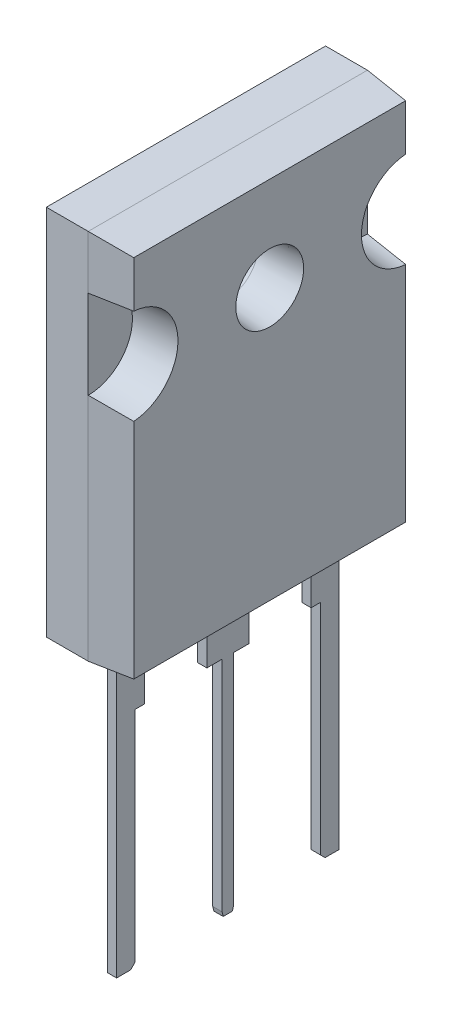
SolidWorks part; units mm, degrees
ref_plane "Front Plane" through (0, 0, 0) normal (0, 0, 1) x (1, 0, 0)
ref_plane "Top Plane" through (0, 0, 0) normal (0, 1, 0) x (1, 0, 0)
ref_plane "Right Plane" through (0, 0, 0) normal (1, 0, 0) x (0, 0, -1)
sketch "Sketch2" plane through (0, 0, 0) normal (1, 0, 0) x (0, 0, -1)
  line L0 (7.62, -2.413) -> (7.62, -14.986)
  line L1 (-7.62, 5.334) -> (7.62, 5.334)
  line L2 (-7.62, 5.334) -> (-7.62, 2.413)
  line L3 (-7.62, -14.986) -> (7.62, -14.986)
  line L4 (7.62, 5.334) -> (7.62, 2.413)
  line L5 (0, -17.9025) -> (0, 11.7071) construction
  line L6 (-7.62, -2.413) -> (-7.62, -14.986)
  arc A1 (7.62, 2.413) -> (7.62, -2.413) centre (7.62, 0) ccw
  arc A2 (-7.62, 2.413) -> (-7.62, -2.413) centre (-7.62, 0) cw
  dimension "D1" = 5.334
  dimension "D6" = 4.826
  dimension "D2" = 7.62
  dimension "D3" = 2.921
  dimension "D5" = 20.32
extrude "Extrude1" add sketch "Sketch2" along normal blind 2.286 draft 5
sketch "Sketch6" plane through (0, 0, 0) normal (-1, 0, 0) x (0, 0, 1)
  line L1 (-7.62, 5.334) -> (7.62, 5.334)
  line L2 (-7.62, 5.334) -> (-7.62, -14.986)
  line L3 (-7.62, -14.986) -> (7.62, -14.986)
  line L4 (7.62, 5.334) -> (7.62, -14.986)
extrude "Extrude2" add sketch "Sketch6" along normal blind 2.286
sketch "Sketch7" plane through (2.286, 0, 0) normal (1, 0, 0) x (0, 0, -1)
  circle A0 centre (0, 0) radius 1.651
  dimension "D1" = 3.302
extrude "Cut-Extrude3" cut sketch "Sketch7" against normal through all
sketch "Sketch9" plane through (0, 0, 0) normal (1, 0, 0) x (0, 0, -1)
  circle A0 centre (0, 0) radius 1.651
  dimension "D1" = 3.302
extrude "Cut-Extrude6" cut sketch "Sketch9" along normal blind 2.286 draft 5
sketch "Sketch10" plane through (0, 0, 0) normal (0, 0, 1) x (1, 0, 0)
  line L0 (0, -14.986) -> (0, -30.734)
  line L1 (2.286, -14.786) -> (0, -14.986) construction
  line L2 (-2.286, -14.986) -> (-2.286, 5.334) construction
  dimension "D1" = 15.748
  dimension "D2" = 2.286
sheet metal parameters "Sheet-Metal1" thickness 0.508 parameters "D1"=0.762
base flange "Base-Flange1" sketch "Sketch10" end condition mid plane depth 2.286 reverse direction no thickness 0.508 reverse thickness direction no bend radius 0.762
sketch "Sketch13" plane through (0, 0, 0) normal (1, 0, 0) x (0, 0, -1)
  line L0 (0, 6.4433) -> (0, -32.38) construction
  line L1 (-1.143, -14.986) -> (1.143, -14.986) construction
  line L2 (-1.143, -30.734) -> (-0.254, -30.734)
  line L3 (-1.143, -30.734) -> (-1.143, -18.542)
  line L4 (-1.143, -18.542) -> (-0.3175, -18.542)
  line L5 (-0.3175, -30.48) -> (-0.3175, -18.542)
  line L6 (-0.254, -30.734) -> (-0.3175, -30.48)
  line L7 (0.254, -30.734) -> (0.3175, -30.48)
  line L8 (0.3175, -30.48) -> (0.3175, -18.542)
  line L9 (1.143, -18.542) -> (0.3175, -18.542)
  line L10 (1.143, -30.734) -> (1.143, -18.542)
  line L11 (1.143, -30.734) -> (0.254, -30.734)
  dimension "D1" = 0.635
  dimension "D2" = 3.556
  dimension "D3" = 0.254
  dimension "D4" = 0.254
extrude "Cut-Extrude8" cut sketch "Sketch13" against normal through all
sketch "Sketch15" plane through (0, 0, 0) normal (1, 0, 0) x (0, 0, -1)
  line L0 (-7.62, -14.986) -> (7.62, -14.986) construction
  line L1 (-6.0706, -14.986) -> (-4.5466, -14.986)
  line L2 (-6.0706, -14.986) -> (-6.0706, -30.734)
  line L3 (-6.0706, -30.734) -> (-5.3086, -30.734)
  line L4 (-4.5466, -14.986) -> (-4.5466, -18.542)
  line L6 (-5.5626, -32.5888) -> (-5.5626, -13.5219) construction
  line L7 (-5.3086, -30.734) -> (-5.0546, -30.48)
  line L8 (0, 9.0004) -> (0, -42.1241) construction
  line L9 (5.5626, -32.5888) -> (5.5626, -13.5219) construction
  line L10 (-4.5466, -18.542) -> (-5.0546, -18.542)
  line L11 (-5.0546, -30.48) -> (-5.0546, -18.542)
  line L12 (5.0546, -30.48) -> (5.0546, -18.542)
  line L13 (4.5466, -18.542) -> (5.0546, -18.542)
  line L14 (5.3086, -30.734) -> (5.0546, -30.48)
  line L15 (4.5466, -14.986) -> (4.5466, -18.542)
  line L16 (6.0706, -30.734) -> (5.3086, -30.734)
  line L17 (6.0706, -14.986) -> (6.0706, -30.734)
  line L18 (6.0706, -14.986) -> (4.5466, -14.986)
  dimension "D1" = 15.748
  dimension "D2" = 5.5626
  dimension "D3" = 0.508
  dimension "D4" = 0.508
  dimension "D5" = 1.016
  dimension "D6" = 3.556
  dimension "D7" = 0.254
  dimension "D8" = 0.254
extrude "Extrude3" add sketch "Sketch15" against normal blind 0.508
flat pattern "Flat-Pattern1"
sketch "Bend-Lines1" plane through (0, 0, 0) normal (0, 1, 0) x (-1, 0, 0)
